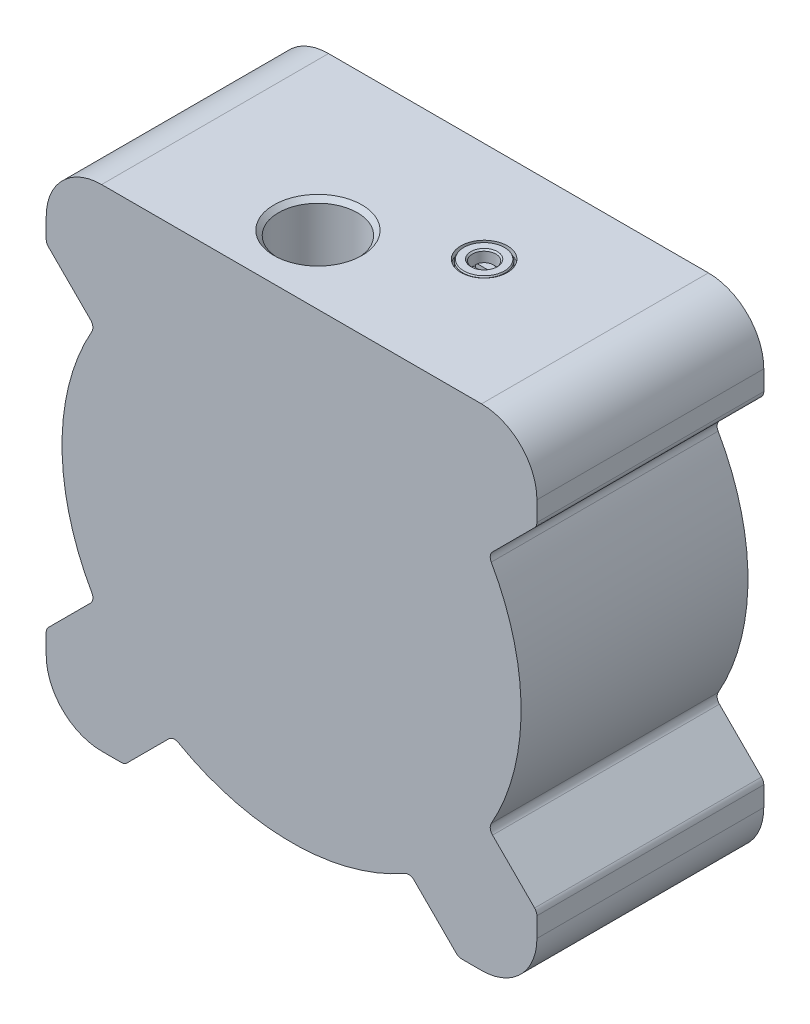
SolidWorks part; units mm, degrees
ref_plane "Plano frontal" through (0, 0, 0) normal (0, 0, 1) x (1, 0, 0)
ref_plane "Plano superior" through (0, 0, 0) normal (0, 1, 0) x (1, 0, 0)
ref_plane "Plano direito" through (0, 0, 0) normal (1, 0, 0) x (0, 0, -1)
imported_body "3"
sketch "Esboço3" plane through (0, 0, 34.2) normal (0, 0, 1) x (1, 0, 0)
  circle A0 centre (0, 0) radius 71.504
extrude "Corte-extrusão2" cut sketch "Esboço3" against normal up to vertex
